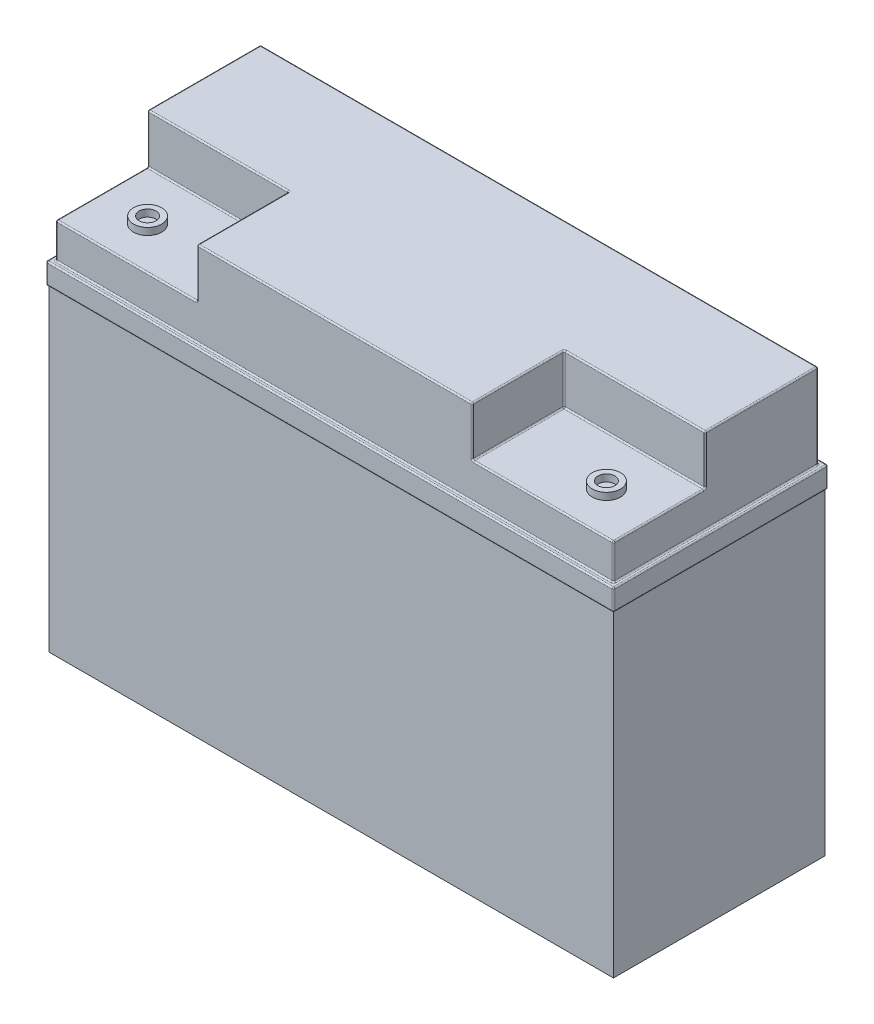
SolidWorks part; units mm, degrees
ref_plane "Front Plane" through (0, 0, 0) normal (0, 0, 1) x (1, 0, 0)
ref_plane "Top Plane" through (0, 0, 0) normal (0, 1, 0) x (1, 0, 0)
ref_plane "Right Plane" through (0, 0, 0) normal (1, 0, 0) x (0, 0, -1)
sketch "Sketch1" plane through (0, 0, 0) normal (0, 0, 1) x (1, 0, 0)
  line L1 (-101.6, 0) -> (101.6, 0)
  line L2 (-101.6, 0) -> (-101.6, 114.3)
  line L3 (-101.6, 114.3) -> (101.6, 114.3)
  line L4 (101.6, 0) -> (101.6, 114.3)
  dimension "D1" = 203.2
  dimension "D2" = 114.3
extrude "Extrude1" add sketch "Sketch1" along normal mid plane 76.2
sketch "Sketch2" plane through (0, 114.3, 0) normal (0, 1, 0) x (1, 0, 0)
  line L8 (100.33, 36.83) -> (-100.33, 36.83)
  line L9 (-100.33, 36.83) -> (-100.33, -36.83)
  line L10 (-100.33, -36.83) -> (100.33, -36.83)
  line L11 (100.33, -36.83) -> (100.33, 36.83)
  line L12 (100.33, 36.83) -> (-100.33, 36.83)
  line L13 (-100.33, 36.83) -> (-100.33, -36.83)
  line L14 (-100.33, -36.83) -> (100.33, -36.83)
  line L15 (100.33, -36.83) -> (100.33, 36.83)
  dimension "D1" = 1.27
extrude "Extrude2" add sketch "Sketch2" along normal blind 38.1
sketch "Sketch3" plane through (0, 114.3, 0) normal (0, 1, 0) x (1, 0, 0)
  line L8 (102.108, 38.608) -> (-102.108, 38.608)
  line L9 (-102.108, 38.608) -> (-102.108, -38.608)
  line L10 (-102.108, -38.608) -> (102.108, -38.608)
  line L11 (102.108, -38.608) -> (102.108, 38.608)
  line L12 (102.108, 38.608) -> (-102.108, 38.608)
  line L13 (-102.108, 38.608) -> (-102.108, -38.608)
  line L14 (-102.108, -38.608) -> (102.108, -38.608)
  line L15 (102.108, -38.608) -> (102.108, 38.608)
  dimension "D1" = 0.508
extrude "Extrude3" add sketch "Sketch3" along normal blind 7.62
sketch "Sketch4" plane through (-100.33, 0, 0) normal (-1, 0, 0) x (0, 0, 1)
  line L1 (36.83, 152.4) -> (3.81, 152.4)
  line L2 (36.83, 152.4) -> (36.83, 134.62)
  line L3 (36.83, 134.62) -> (3.81, 134.62)
  line L4 (3.81, 152.4) -> (3.81, 134.62)
  dimension "D1" = 33.02
  dimension "D2" = 17.78
extrude "Extrude4" cut sketch "Sketch4" against normal blind 50.8
sketch "Sketch5" plane through (0, 134.62, 0) normal (0, 1, 0) x (1, 0, 0)
  line L0 (-49.53, -36.83) -> (-100.33, -36.83) construction
  line L1 (-100.33, -3.81) -> (-100.33, -36.83) construction
  circle A0 centre (-82.55, -21.59) radius 5.08
  dimension "D1" = 10.16
  dimension "D2" = 15.24
  dimension "D3" = 17.78
extrude "Extrude-Thin1" add sketch "Sketch5" along normal blind 2.54 thin
mirror "Mirror1" about plane through (0, 0, 0) normal (1, 0, 0) of "Extrude-Thin1", "Extrude4"
fillet "Fillet1" radius 0.508 42 edges at (0, 121.92, -36.83) (102.108, 121.92, 0) (102.108, 114.3, 0) (0, 121.92, 38.608) (102.108, 118.11, 38.608) (0, 114.3, 38.608) (102.108, 118.11, -38.608) (0, 121.92, -38.608) (0, 114.3, -38.608) (-102.108, 118.11, -38.608) (-102.108, 121.92, 0) (-102.108, 118.11, 38.608) (-102.108, 114.3, 0) (-100.33, 121.92, 0) (-100.33, 137.16, -36.83) (-100.33, 134.62, 20.32) (-74.93, 134.62, 3.81) (-100.33, 143.51, 3.81) (-49.53, 134.62, 20.32) (-49.53, 143.51, 3.81) (49.53, 134.62, 20.32) (74.93, 134.62, 3.81) (49.53, 143.51, 3.81) (100.33, 137.16, -36.83) (100.33, 121.92, 0) (100.33, 134.62, 20.32) (100.33, 143.51, 3.81) (100.33, 128.27, 36.83) (0, 121.92, 36.83) (-100.33, 128.27, 36.83) (-74.93, 134.62, 36.83) (-49.53, 143.51, 36.83) (49.53, 143.51, 36.83) (74.93, 134.62, 36.83) (0, 152.4, 36.83) (-49.53, 152.4, 20.32) (-74.93, 152.4, 3.81) (-100.33, 152.4, -16.51) (0, 152.4, -36.83) (100.33, 152.4, -16.51) (74.93, 152.4, 3.81) (49.53, 152.4, 20.32)
